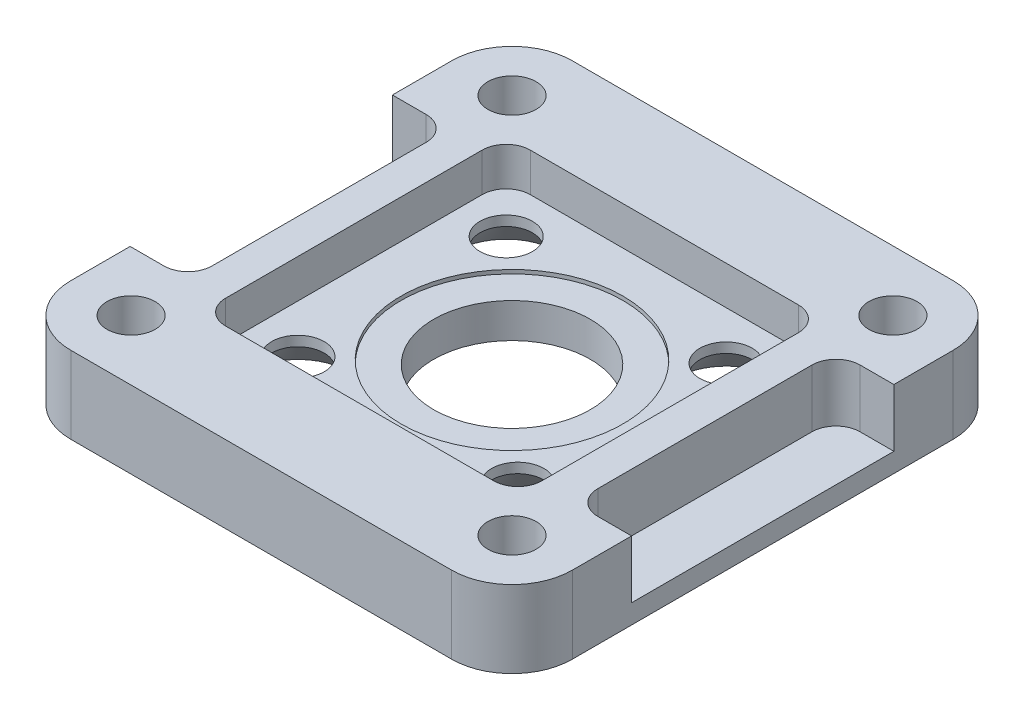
SolidWorks part; units mm, degrees
ref_plane "Front Plane" through (0, 0, 0) normal (0, 0, 1) x (1, 0, 0)
ref_plane "Top Plane" through (0, 0, 0) normal (0, 1, 0) x (1, 0, 0)
ref_plane "Right Plane" through (0, 0, 0) normal (1, 0, 0) x (0, 0, -1)
sketch "Sketch1" plane through (0, 0, 0) normal (0, 1, 0) x (1, 0, 0)
  line L0 (16.51, -16.51) -> (16.51, 16.51)
  line L1 (-16.51, -16.51) -> (16.51, -16.51)
  line L3 (-16.51, 16.51) -> (16.51, 16.51)
  line L5 (-16.51, -16.51) -> (16.51, 16.51) construction
  line L6 (-16.51, 16.51) -> (16.51, -16.51) construction
  line L7 (-16.51, -16.51) -> (-16.51, 16.51)
  point P0 (0, 0)
  dimension "D1" = 33.02
  dimension "D2" = 33.02
extrude "Boss-Extrude1" add sketch "Sketch1" along normal blind 5.08
sketch "Sketch6" plane through (0, 5.08, 0) normal (0, -1, 0) x (1, 0, 0)
  line L0 (9.779, 9.398) -> (-9.779, 9.398) construction
  line L1 (8.8265, -10.033) -> (-8.8265, -10.033)
  line L2 (10.414, -8.4455) -> (10.414, 8.4455)
  line L3 (8.8265, 10.033) -> (-8.8265, 10.033)
  line L4 (-10.414, -8.4455) -> (-10.414, 8.4455)
  line L5 (10.414, -10.033) -> (-10.414, 10.033) construction
  line L6 (10.414, 10.033) -> (-10.414, -10.033) construction
  line L7 (-9.779, -9.398) -> (-9.779, 9.398) construction
  arc A1 (10.414, 8.4455) -> (8.8265, 10.033) centre (8.8265, 8.4455) ccw
  arc A2 (8.8265, -10.033) -> (10.414, -8.4455) centre (8.8265, -8.4455) ccw
  arc A3 (-8.8265, -10.033) -> (-10.414, -8.4455) centre (-8.8265, -8.4455) cw
  arc A4 (-8.8265, 10.033) -> (-10.414, 8.4455) centre (-8.8265, 8.4455) ccw
  point P0 (0, 0)
  dimension "D1" = 0.635
  dimension "D3" = 1.5875
  dimension "D2" = 0.635
extrude "Cut-Extrude1" cut sketch "Sketch6" along normal offset from surface (2.54 mm away) 2.54
hole_wizard "CSK for #4 Flat Head Machine Screw1" positions "Sketch2" profile "Sketch3" countersink size "#4" standard "ANSI Inch"
sketch "Sketch2" plane through (0, 0, 0) normal (0, 1, 0) x (1, 0, 0)
  line L1 (-7.239, 6.858) -> (7.239, 6.858) construction
  line L2 (-7.239, 6.858) -> (-7.239, -6.858) construction
  line L3 (-7.239, -6.858) -> (7.239, -6.858) construction
  line L4 (7.239, 6.858) -> (7.239, -6.858) construction
  line L5 (-7.239, -6.858) -> (7.239, 6.858) construction
  circle A0 centre (-7.239, 6.858) radius 1.4224 construction
  point P0 (-7.239, -6.858)
  point P2 (-7.239, 6.858)
  point P4 (7.239, 6.858)
  point P6 (7.239, -6.858)
sketch "Sketch3" plane through (-7.239, 0, 6.858) normal (1, 0, 0) x (0, 0, -1)
  line L0 (0, 0) -> (0, 5.08)
  line L1 (0, 5.08) -> (1.7272, 5.08)
  line L2 (1.7272, 5.08) -> (1.7272, 1.8846)
  line L3 (1.7272, 1.8846) -> (3.3655, 0)
  line L5 (3.3655, 0) -> (0, 0)
  line L6 (-1.7272, 1.8846) -> (-3.3655, 0) construction
  line L11 (0, -6.35) -> (0, 107.95) construction
  dimension "Thru Hole Dia." = 3.4544
  dimension "Thru Hole Depth" = 5.08
  dimension "Near C'Sink Dia." = 6.731
  dimension "Near C'Sink Angle" = 82
hole_wizard "1/8 (0.125) Diameter Hole1" positions "Sketch4" profile "Sketch5" hole size "1/8" standard "ANSI Inch"
sketch "Sketch4" plane through (0, 5.08, 0) normal (0, 1, 0) x (1, 0, 0)
  line L1 (-12.5413, 12.5413) -> (12.5413, 12.5413) construction
  line L2 (-12.5413, 12.5413) -> (-12.5413, -12.5412) construction
  line L3 (-12.5413, -12.5412) -> (12.5413, -12.5412) construction
  line L4 (12.5413, 12.5413) -> (12.5413, -12.5412) construction
  line L5 (12.5413, -12.5412) -> (-12.5413, 12.5413) construction
  line L7 (16.51, 16.51) -> (-16.51, 16.51) construction
  line L8 (16.51, 16.51) -> (-16.51, 16.51) construction
  line L9 (-16.51, 16.51) -> (-16.51, -16.51) construction
  circle A0 centre (-12.5413, 12.5413) radius 3.9688 construction
  point P0 (-12.5413, 12.5413)
  point P2 (12.5413, 12.5413)
  point P4 (12.5413, -12.5412)
  point P6 (-12.5413, -12.5412)
  dimension "D1" = 7.9375
sketch "Sketch5" plane through (-12.5413, 5.08, -12.5413) normal (1, 0, 0) x (0, 0, 1)
  line L0 (0, 0) -> (0, 5.08)
  line L1 (0, 5.08) -> (1.5875, 5.08)
  line L2 (1.5875, 5.08) -> (1.5875, 0)
  line L5 (1.5875, 0) -> (0, 0)
  line L11 (0, -6.35) -> (0, 107.95) construction
  dimension "Thru Hole Dia." = 3.175
  dimension "Thru Hole Depth" = 5.08
fillet "Fillet1" radius 3.9688 4 edges at (16.51, 2.54, -16.51) (-16.51, 2.54, -16.51) (16.51, 2.54, 16.51) (-16.51, 2.54, 16.51)
sketch "Sketch7" plane through (0, 5.08, 0) normal (0, 1, 0) x (1, 0, 0)
  line L0 (-16.51, 12.5413) -> (-16.51, -12.5412) construction
  line L4 (-16.51, 8.636) -> (-14.2875, 8.636)
  line L8 (-16.51, 8.636) -> (-16.51, -8.636)
  line L9 (-16.51, -8.636) -> (-14.2875, -8.636)
  line L10 (-12.7, 7.0485) -> (-12.7, -7.0485)
  line L11 (16.51, -12.5413) -> (16.51, 12.5413) construction
  line L12 (16.51, 8.636) -> (14.2875, 8.636)
  line L13 (16.51, 8.636) -> (16.51, -8.636)
  line L14 (16.51, -8.636) -> (14.2875, -8.636)
  line L15 (12.7, 7.0485) -> (12.7, -7.0485)
  line L16 (0, 0) -> (-12.7, 0) construction
  arc A6 (14.2875, 8.636) -> (12.7, 7.0485) centre (14.2875, 7.0485) ccw
  arc A7 (14.2875, -8.636) -> (12.7, -7.0485) centre (14.2875, -7.0485) cw
  arc A8 (-14.2875, -8.636) -> (-12.7, -7.0485) centre (-14.2875, -7.0485) ccw
  arc A9 (-14.2875, 8.636) -> (-12.7, 7.0485) centre (-14.2875, 7.0485) cw
  dimension "D2" = 3.81
  dimension "D1" = 1.5875
  dimension "D3" = 17.272
extrude "Cut-Extrude2" cut sketch "Sketch7" against normal offset from surface (3.81 mm away) 1.27
hole_wizard "Hole1" positions "Sketch8" profile "Sketch9" legacy
sketch "Sketch8" plane through (0, 2.54, 0) normal (0, -1, 0) x (-1, 0, 0)
  point P0 (0, 0)
sketch "Sketch9" plane through (0, 2.54, 0) normal (1, 0, 0) x (0, 0, 1)
  line L0 (0, 0) -> (0, 2.54)
  line L1 (0, 2.54) -> (5.1594, 2.54)
  line L2 (5.1594, 2.54) -> (5.1594, 0.254)
  line L3 (5.1594, 0.254) -> (7.3025, 0.254)
  line L4 (7.3025, 0.254) -> (7.3025, 0)
  line L5 (7.3025, 0) -> (0, 0)
  line L6 (0, 110) -> (0, -10) construction
  dimension "Diameter" = 10.3187
  dimension "Depth" = 2.54
  dimension "C-Bore Diameter" = 14.605
  dimension "C-Bore Depth" = 0.254
